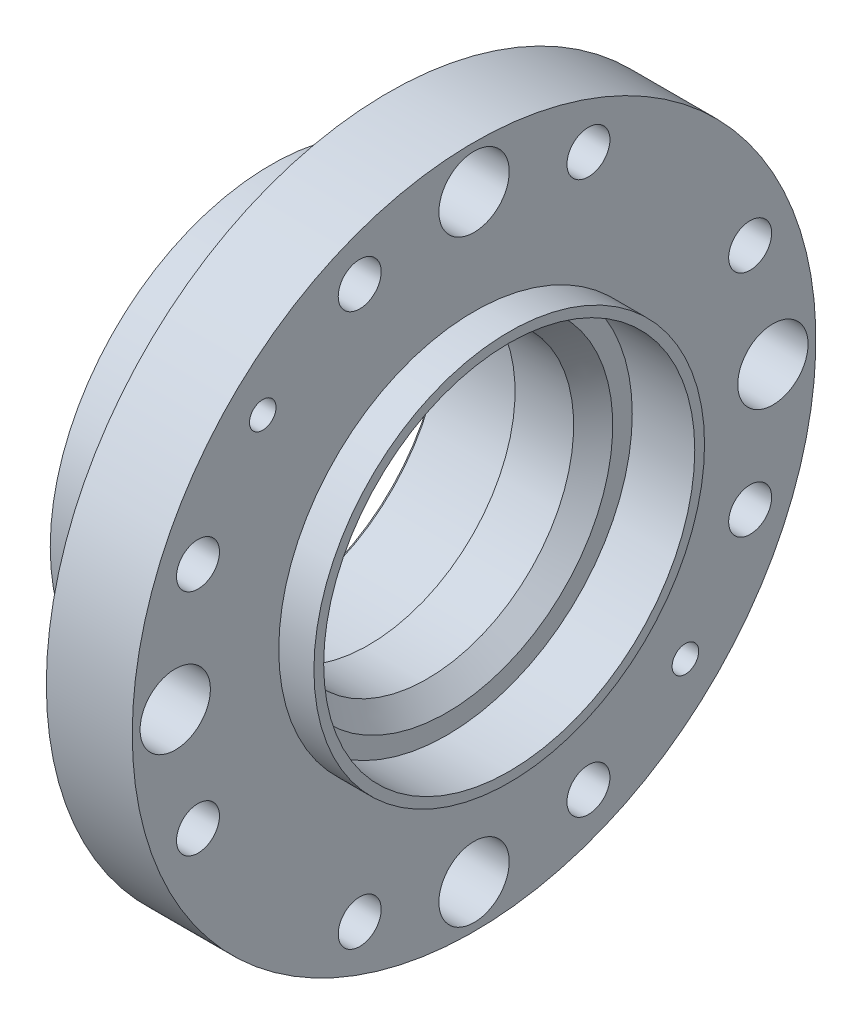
SolidWorks part; units mm, degrees
ref_plane "Plan de face" through (0, 0, 0) normal (0, 0, 1) x (1, 0, 0)
ref_plane "Plan de dessus" through (0, 0, 0) normal (0, 1, 0) x (1, 0, 0)
ref_plane "Plan de droite" through (0, 0, 0) normal (1, 0, 0) x (0, 0, -1)
sketch "Esquisse1" plane through (0, 0, 0) normal (0, 0, 1) x (1, 0, 0)
  line L0 (0.0002, 56.5001) -> (0.0002, 42.4994)
  line L1 (22.0004, 56.5001) -> (0.0002, 56.5001)
  line L2 (25.0002, 42.4994) -> (0.0002, 42.4994)
  line L28 (51.9998, 87.4997) -> (51.9998, 49.9999)
  line L52 (51.9998, 87.4997) -> (30.0004, 87.4997)
  line L57 (30.0004, 87.4997) -> (30.0004, 64.5001)
  line L58 (22.0004, 56.5001) -> (0.0002, 56.5001)
  line L67 (25.0002, 42.4994) -> (25.0002, 37.4989)
  line L68 (25.0002, 37.4989) -> (40.0002, 37.4989)
  line L69 (40.0002, 37.4989) -> (45.0002, 42.4989)
  line L70 (45.0002, 42.4989) -> (45.0002, 47.4989)
  line L71 (45.0002, 47.4989) -> (60.9998, 47.4989)
  line L72 (60.9998, 47.4989) -> (60.9998, 49.9999)
  line L73 (60.9998, 49.9999) -> (51.9998, 49.9999)
  line L110 (0, 0) -> (127.5713, 0) construction
  arc A22 (22.0004, 56.5001) -> (30.0004, 64.5001) centre (22.0004, 64.5001) ccw
  arc A40 (30.0004, 64.5001) -> (22.0004, 56.5001) centre (22.0004, 64.5001) cw
  dimension "D14" = 14.0007
  dimension "D15" = 5.0006
  dimension "D16" = 8
  dimension "D2" = 37.4989
  dimension "D3" = 42.4989
  dimension "D4" = 9
  dimension "D5" = 47.4989
  dimension "D6" = 49.9999
  dimension "D7" = 87.4997
  dimension "D8" = 21.9994
  dimension "D9" = 15
  dimension "D10" = 5
  dimension "D12" = 22.0002
  dimension "D13" = 25
revolve "Révolution1" add sketch "Esquisse1" angle 360 about L110
sketch "Esquisse2" plane through (30.0004, 0, 0) normal (-1, 0, 0) x (0, 0, 1)
  line L0 (0, 94.5485) -> (0, 0) construction
  line L1 (0, 0) -> (-40.2222, 97.1049) construction
  line L2 (0.001, 0) -> (-29.2753, 70.6768) construction
  line L3 (0.001, 0) -> (29.2756, 70.6775) construction
  circle A0 centre (0, 0) radius 76.5 construction
  circle A1 centre (-29.2753, 70.6768) radius 5.5
  circle A2 centre (29.2756, 70.6775) radius 5.5
  dimension "D2" = 153
  dimension "D3" = 11
  dimension "D1" = 22.5
  dimension "D4" = 45
extrude "Extrusion1" cut sketch "Esquisse2" against normal blind 28
pattern_circular "Répétition circulaire1" count 4 over 360 about axis through (0, 0, 0) along (1, 0, 0) of "Extrusion1"
sketch "Esquisse3" plane through (30.0004, 0, 0) normal (-1, 0, 0) x (0, 0, 1)
  line L0 (0, 95.003) -> (0, 0) construction
  circle A0 centre (0, 76.5) radius 9
  circle A1 centre (0, 0) radius 76.5 construction
  circle A2 centre (76.5, 0) radius 9
  circle A3 centre (0, -76.5) radius 9
  circle A4 centre (-76.5, 0) radius 9
  dimension "D1" = 18
extrude "Extrusion2" cut sketch "Esquisse3" against normal blind 28
sketch "Esquisse4" plane through (30.0004, 0, 0) normal (-1, 0, 0) x (0, 0, 1)
  line L0 (0, 109.9126) -> (0, 0) construction
  line L1 (0, 0) -> (87.796, 87.796) construction
  circle A0 centre (0, 0) radius 76.5 construction
  circle A1 centre (54.0937, 54.0937) radius 7.5
  point P3 (54.0937, 54.0937)
  dimension "D2" = 15
  dimension "D1" = 45
extrude "Extrusion3" cut sketch "Esquisse4" against normal blind 10
hole_wizard "Trou taraudé M81" positions "Esquisse3D3" profile "Esquisse8" tap size "M8" standard "ISO"
sketch3d "Esquisse3D3"
  line L0 (40.0004, 54.0937, 54.0937) -> (30.0004, 54.0937, 54.0937) construction
  point P0 (40.0004, 54.0937, 54.0937)
sketch "Esquisse8" plane through (40.0004, 54.0937, 54.0937) normal (0, 1, 0) x (0, 0, 1)
  line L0 (0, 0) -> (0, 20.9994)
  line L1 (0, 20.9994) -> (3.4, 20.9994)
  line L2 (3.4, 20.9994) -> (3.4, 0)
  line L5 (3.4, 0) -> (0, 0)
  line L11 (0, -6.35) -> (0, 107.95) construction
  dimension "Diamètre du trou pour taraudage jusqu'au prochain" = 6.8
  dimension "Profondeur du trou pour taraudage jusqu'au prochain" = 20.9994
pattern_circular "Répétition circulaire2" count 2 over 360 about axis through (0, 0, 0) along (1, 0, 0) of "Extrusion3", "Trou taraudé M81"
fillet "Congé3" radius 1 1 edges at (25.0002, 0, 42.4994)
chamfer "Chanfrein1" distance 1 angle 45 1 edges at (0.0002, 0, 42.4994)
hole_wizard "Trou taraudé M62" positions "Esquisse12" profile "Esquisse11" tap size "M6" standard "ISO"
sketch "Esquisse12" plane through (0.0002, 0, 0) normal (-1, 0, 0) x (0, 0, 1)
  point P0 (0, 48.5)
  dimension "D1" = 48.5
sketch "Esquisse11" plane through (0.0002, 48.5, 0) normal (0, 1, 0) x (0, 0, 1)
  line L0 (0, 0) -> (0, 19.5022)
  line L1 (0, 19.5022) -> (2.5, 18)
  line L2 (2.5, 18) -> (2.5, 0)
  line L5 (2.5, 0) -> (0, 0)
  line L10 (0, 19.5022) -> (-2.5, 18) construction
  line L11 (0, -6.35) -> (0, 107.95) construction
  dimension "Diamètre du trou pour taraudage" = 5
  dimension "Profondeur du trou pour taraudage" = 18
  dimension "Angle de pointe" = 118
pattern_circular "Répétition circulaire4" count 8 every 45 about axis through (0, 0, 0) along (1, 0, 0) of "Trou taraudé M62"
